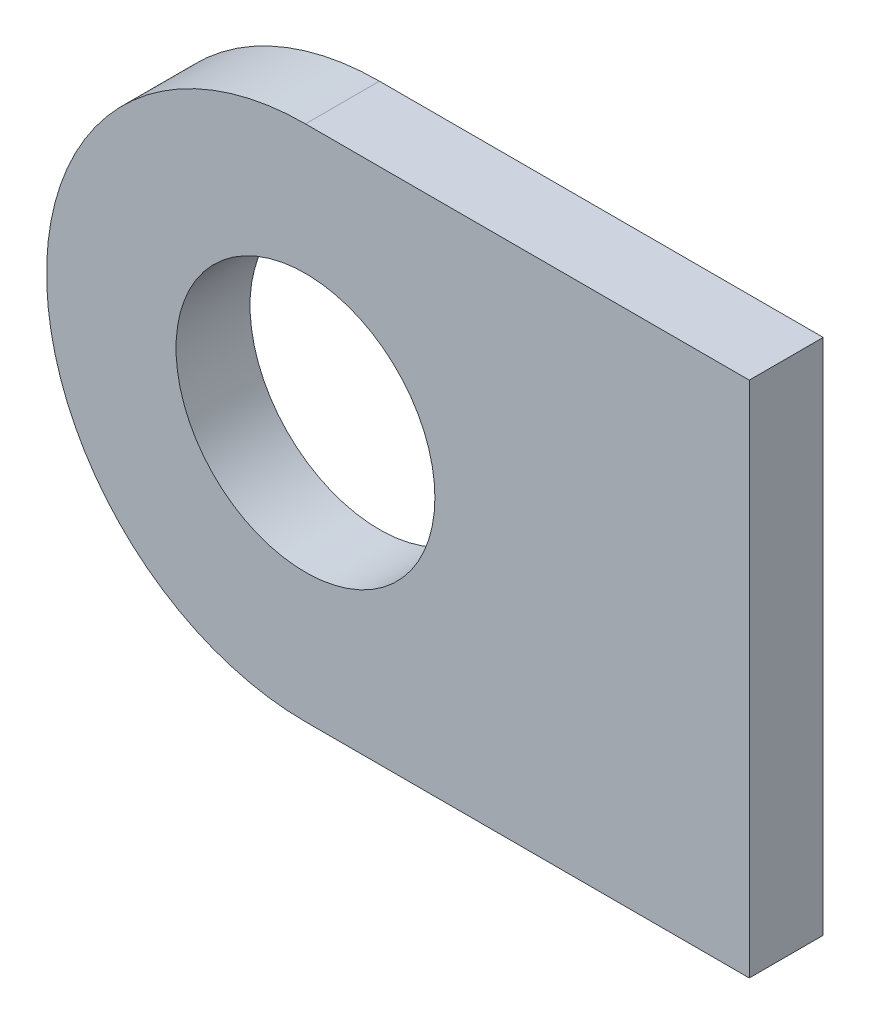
SolidWorks part; units mm, degrees
ref_plane "Front Plane" through (0, 0, 0) normal (0, 0, 1) x (1, 0, 0)
ref_plane "Top Plane" through (0, 0, 0) normal (0, 1, 0) x (1, 0, 0)
ref_plane "Right Plane" through (0, 0, 0) normal (1, 0, 0) x (0, 0, -1)
sketch "Sketch1" plane through (0, 0, 0) normal (0, 0, 1) x (1, 0, 0)
  line L1 (0, 0) -> (-60, 0)
  line L2 (0, 0) -> (0, -70)
  line L3 (0, -70) -> (-60, -70)
  arc A0 (-60, -70) -> (-60, 0) centre (-60, -35) cw
  circle A1 centre (-60, -35) radius 17.5
  dimension "D1" = 60
  dimension "D3" = 35
  dimension "D2" = 70
extrude "Boss-Extrude1" add sketch "Sketch1" along normal blind 10 contours L1 A0 L3 L2
